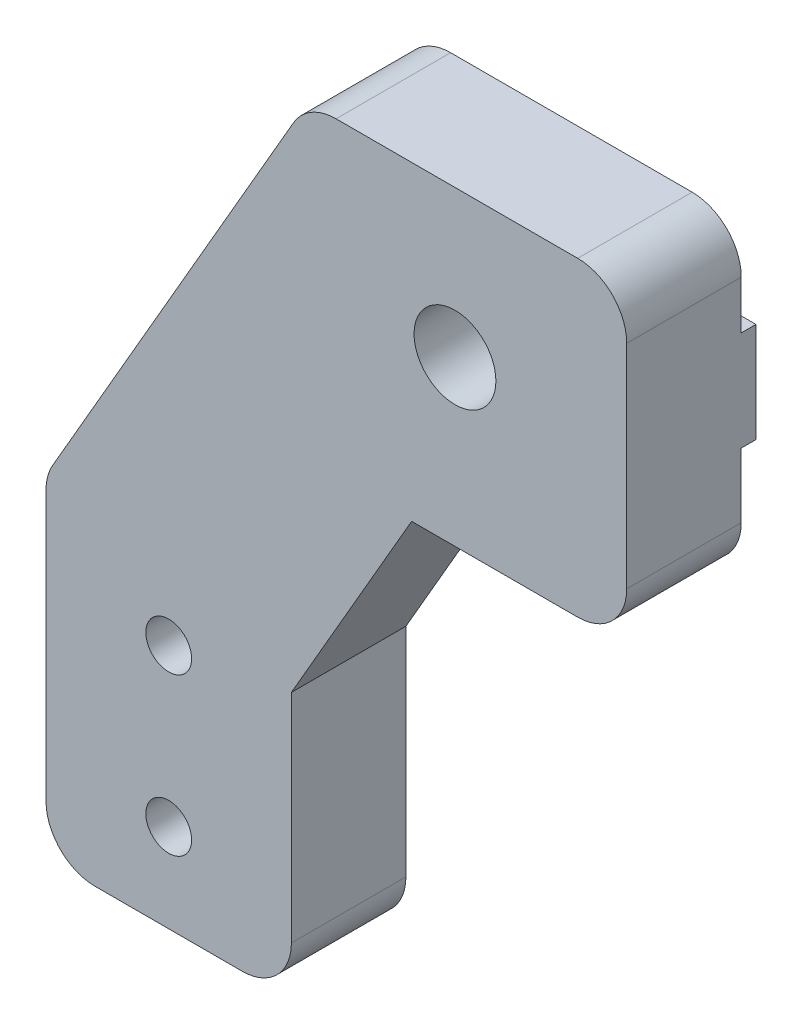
SolidWorks part; units mm, degrees
ref_plane "Front Plane" through (0, 0, 0) normal (0, 0, 1) x (1, 0, 0)
ref_plane "Top Plane" through (0, 0, 0) normal (0, 1, 0) x (1, 0, 0)
ref_plane "Right Plane" through (0, 0, 0) normal (1, 0, 0) x (0, 0, -1)
sketch "Sketch1" plane through (0, 0, 0) normal (0, 0, 1) x (1, 0, 0)
  line L0 (3, 0) -> (12, 0)
  line L1 (15, 3) -> (15, 16.2679)
  line L2 (22.3509, 29) -> (32.5, 29)
  line L4 (32.5, 48) -> (17.7321, 48)
  line L5 (0, 19.4833) -> (0, 3)
  line L7 (15, 16.2679) -> (22.3509, 29)
  line L8 (7.5, 0) -> (7.5, 48) construction
  line L9 (15.134, 46.5) -> (0.4019, 20.9833)
  line L10 (35.5, 32) -> (35.5, 45)
  circle A0 centre (25, 39) radius 2.5
  arc A1 (35.5, 32) -> (32.5, 29) centre (32.5, 32) cw
  circle A2 centre (7.5, 5.4) radius 1.4
  circle A3 centre (7.5, 15) radius 1.4
  arc A4 (35.5, 45) -> (32.5, 48) centre (32.5, 45) ccw
  arc A7 (0, 19.4833) -> (0.4019, 20.9833) centre (3, 19.4833) cw
  arc A8 (0, 3) -> (3, 0) centre (3, 3) ccw
  arc A9 (12, 0) -> (15, 3) centre (12, 3) ccw
  arc A10 (15.134, 46.5) -> (17.7321, 48) centre (17.7321, 45) cw
  point P32 (0, 48)
  point P35 (0, 0)
  point P38 (15, 0)
  point P41 (16, 48)
  dimension "D5" = 5
  dimension "D6" = 19
  dimension "D7" = 25
  dimension "D8" = 3
  dimension "D10" = 2.8
  dimension "D11" = 2.8
  dimension "D12" = 5.4
  dimension "D13" = 9.6
  dimension "D14" = 15
  dimension "D18" = 3
  dimension "D19" = 3
  dimension "D1" = 48
  dimension "D2" = 15
  dimension "D3" = 9
  dimension "D4" = 28
  dimension "D16" = 120
  dimension "D17" = 16
extrude "Boss-Extrude1" add sketch "Sketch1" along normal blind 7
sketch "Sketch2" plane through (35.5, 0, 0) normal (1, 0, 0) x (0, 0, -1)
  line L1 (0, 42.05) -> (0.9, 42.05)
  line L2 (0, 42.05) -> (0, 35.95)
  line L3 (0, 35.95) -> (0.9, 35.95)
  line L4 (0.9, 42.05) -> (0.9, 35.95)
  line L6 (0.9, 39) -> (-7, 39) construction
  line L7 (-7, 32) -> (-7, 45) construction
  line L8 (0, 32) -> (0, 45) construction
  dimension "D1" = 6.1
  dimension "D2" = 0.9
extrude "Boss-Extrude2" add sketch "Sketch2" against normal up to surface (22.9352 mm away) contours L3 L4 L1 L2
sketch "Sketch3" plane through (0, 0, 0) normal (0, 0, 1) x (1, 0, 0)
  circle A0 centre (25, 39) radius 2.5 construction
  circle A2 centre (25, 39) radius 2.5
extrude "Cut-Extrude1" cut sketch "Sketch3" against normal up to next
